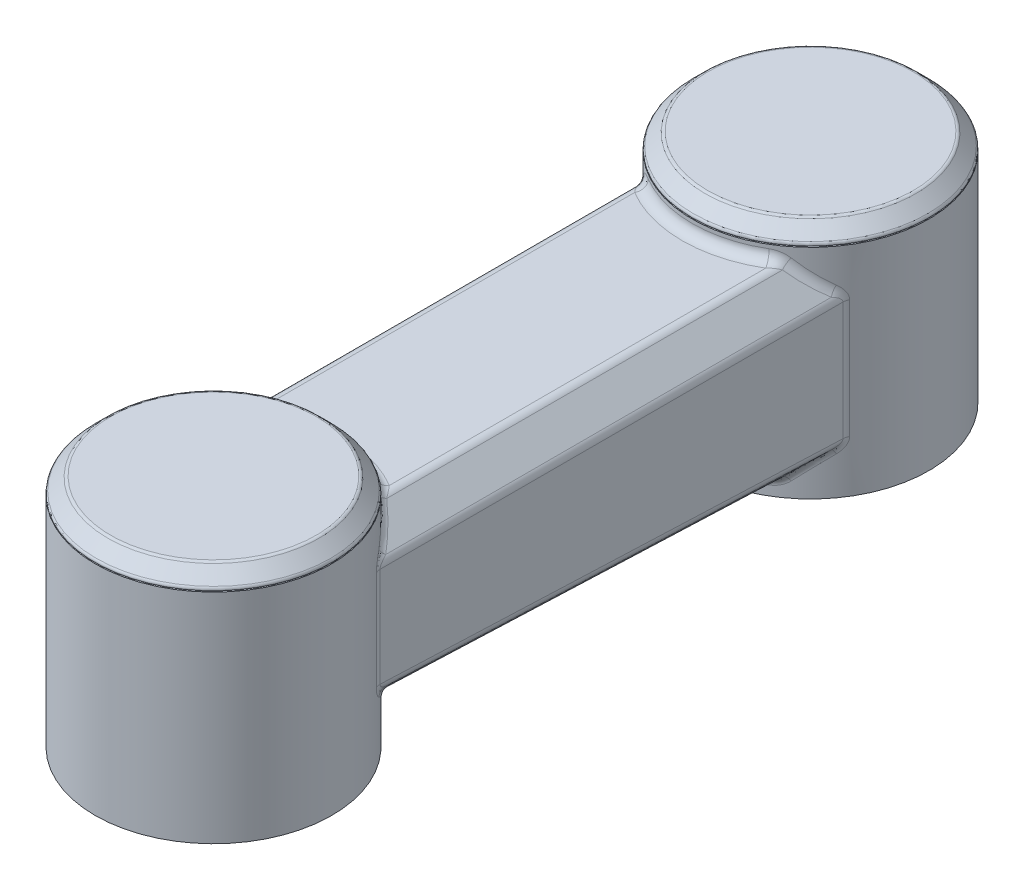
SolidWorks part; units mm, degrees
ref_plane "Ön Düzlem" through (0, 0, 0) normal (0, 0, 1) x (1, 0, 0)
ref_plane "Üst Düzlem" through (0, 0, 0) normal (0, 1, 0) x (1, 0, 0)
ref_plane "Sağ Düzlem" through (0, 0, 0) normal (1, 0, 0) x (0, 0, -1)
sketch "Çizim1" plane through (0, 0, 0) normal (1, 0, 0) x (0, 0, -1)
  line L1 (0, 0) -> (-59.5, 0)
  line L2 (0, 0) -> (0, 110)
  line L3 (0, 110) -> (-59.5, 110)
  line L4 (-59.5, 0) -> (-59.5, 110)
  line L5 (0, 0) -> (-45, 0)
  line L6 (0, 0) -> (0, -7)
  line L7 (0, -7) -> (-45, -7)
  line L8 (-45, 0) -> (-45, -7)
  dimension "D1" = 59.5
  dimension "D2" = 110
  dimension "D3" = 7
  dimension "D4" = 45
revolve "Döndür1" add sketch "Çizim1" angle 360 about L2
sketch "Çizim2" plane through (0, 110, 0) normal (0, 1, 0) x (1, 0, 0)
  circle A0 centre (0, 0) radius 59.5
extrude "Yükseklik-Ekstrüzyon1" add sketch "Çizim2" along normal blind 8 separate body
chamfer "Pah1" distance 0.5 angle 45 1 edges at (0, 110, -59.5)
chamfer "Pah2" distance 7 angle 45 1 edges at (0, 118, 59.5)
fillet "Radyus1" radius 2 2 edges at (0, 111, 59.5) (0, 118, 52.5)
sketch "Çizim3" plane through (0, 0, 0) normal (0, 0, 1) x (1, 0, 0)
  line L0 (0, 110.1716) -> (0, 0) construction
  line L1 (-59.5, 110.1716) -> (59.5, 110.1716) construction
  line L3 (50, 7.5858) -> (-50, 7.5858)
  line L4 (50, 7.5858) -> (50, 102.5858)
  line L5 (50, 102.5858) -> (-50, 102.5858)
  line L6 (-50, 7.5858) -> (-50, 102.5858)
  line L7 (50, 7.5858) -> (-50, 102.5858) construction
  line L8 (50, 102.5858) -> (-50, 7.5858) construction
  point P5 (0, 55.0858)
  dimension "D1" = 95
  dimension "D2" = 100
ref_plane "Düzlem1" through (0, 0, 285) normal (0, 0, 1) x (1, 0, 0)
sketch "Çizim4" plane through (0, 0, 285) normal (0, 0, 1) x (1, 0, 0)
  line L0 (50, 7.5858) -> (-50, 102.5858) construction
  line L2 (50, 19.1687) -> (50, 102.5858)
  line L3 (50, 102.5858) -> (-50, 102.5858)
  line L4 (-50, 19.1687) -> (-50, 102.5858)
  line L5 (37.8075, 19.1687) -> (-50, 102.5858) construction
  line L6 (50, 102.5858) -> (-37.8075, 19.1687) construction
  line L7 (-50, 19.1687) -> (50, 19.1687)
  point P0 (0, 55.0858)
  dimension "D1" = 100
loft "Loft1" add profiles "Çizim4", "Çizim3"
ref_plane "Düzlem2" through (0, 0, 150) normal (0, 0, 1) x (1, 0, 0)
mirror "Aynalama1" about plane through (0, 0, 150) normal (0, 0, 1) of "Pah2", "Yükseklik-Ekstrüzyon1", "Döndür1", "Pah1", "Radyus1"
mirror "Aynalama3" about plane through (0, 0, 150) normal (0, 0, 1)
chamfer "Pah3" distance 15 angle 45 4 edges
fillet "Radyus2" radius 5 24 edges at (43.2339, 26.3576, 259.1211) (43.2339, 17.4878, 40.8789) (43.2339, 94.3519, 40.8789) (43.2339, 94.3519, 259.1211) (50, 87.5858, 150) (50, 55.7474, 32.2529) (50, 28.6944, 150) (50, 60.5328, 267.7471) (0, 17.3601, 240.5) (35, 13.6821, 150) (0, 10.004, 59.5) (-35, 13.6821, 150) (-43.2339, 17.4878, 40.8789) (-43.2339, 26.3576, 259.1211) (-50, 28.6944, 150) (-50, 55.7474, 32.2529) (-50, 60.5328, 267.7471) (-50, 87.5858, 150) (-43.2339, 94.3519, 40.8789) (-43.2339, 94.3519, 259.1211) (-35, 102.5858, 150) (0, 102.5858, 59.5) (35, 102.5858, 150) (0, 102.5858, 240.5)
